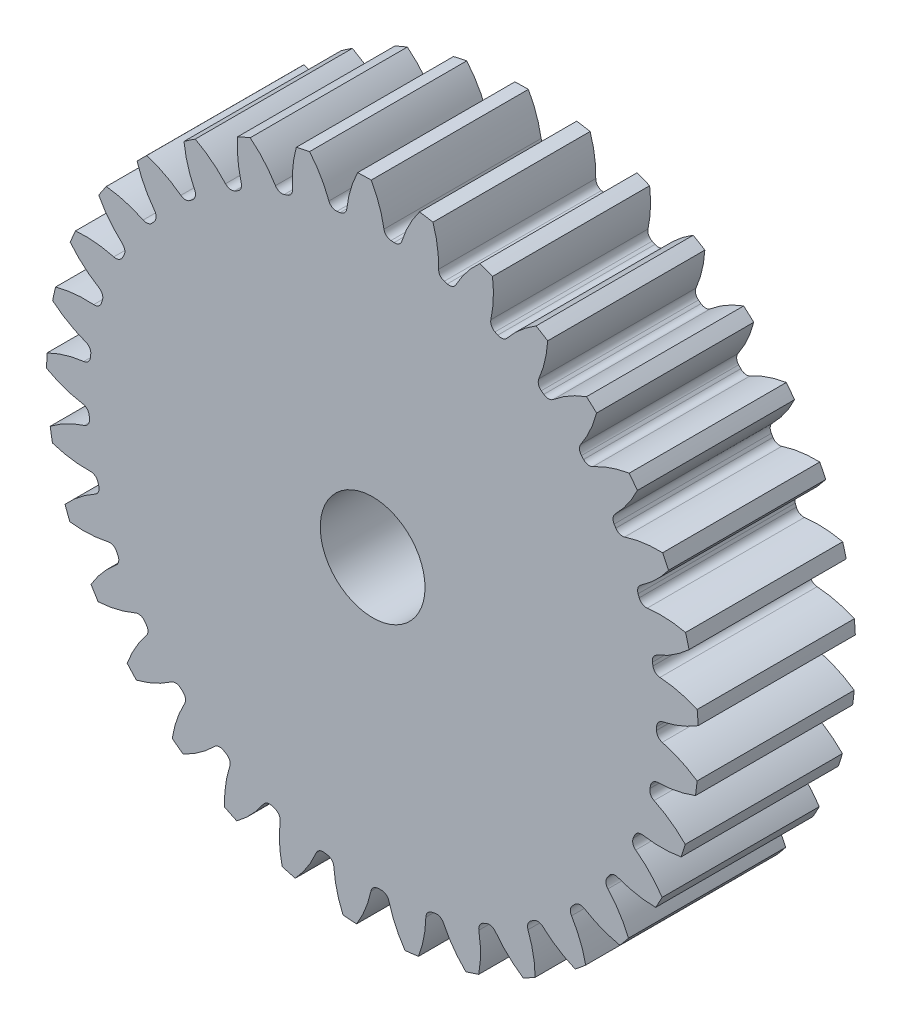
SolidWorks part; units mm, degrees
ref_plane "Front" through (0, 0, 0) normal (0, 0, 1) x (1, 0, 0)
ref_plane "Top" through (0, 0, 0) normal (0, 1, 0) x (1, 0, 0)
ref_plane "Right" through (0, 0, 0) normal (1, 0, 0) x (0, 0, -1)
sketch "Sketch3" plane through (0, 0, 0) normal (0, 0, 1) x (1, 0, 0)
  circle A0 centre (0, 0) radius 197.5556
  dimension "od" = 395.1111
extrude "gearBody" add sketch "Sketch3" along normal blind 95.25
sketch "Sketch2" plane through (0, 0, 0) normal (0, 0, 1) x (1, 0, 0)
  line L0 (0, 0) -> (161.7098, 66.9824) construction
  line L1 (196.8888, -19.271) -> (0, 0) construction
  line L2 (0, 0) -> (36.3143, 0) construction
  line L3 (186.2086, 4.6511) -> (185.8119, -13.0086) construction
  line L5 (186.0102, -4.1787) -> (0, 0) construction
  line L7 (0, 0) -> (175.0334, 0) construction
  arc A0 (175.0282, 1.3471) -> (174.7912, -9.2058) centre (0, 0) ccw construction
  arc A1 (197.2899, 10.2423) -> (196.6309, -19.0918) centre (0, 0) ccw construction
  arc A2 (186.2086, 4.6511) -> (185.8119, -13.0086) centre (0, 0) ccw construction
  arc A3 (172.0881, -4.8183) -> (172.1309, -2.9145) centre (0, 0) ccw
  arc A4 (196.8888, -19.271) -> (175.5162, -9.3914) centre (158.5386, -74.1768) ccw
  arc A5 (196.8888, -19.271) -> (197.5556, 10.4098) centre (0, 0) ccw
  arc A6 (197.5556, 10.4098) -> (175.7609, 1.5) centre (161.7098, 66.9824) cw
  arc A7 (172.1309, -2.9145) -> (175.7609, 1.5) centre (176.7248, -2.9923) cw
  arc A8 (175.5162, -9.3914) -> (172.0881, -4.8183) centre (176.6809, -4.9469) cw
  point P6 (197.5556, 10.4098)
  point P22 (196.8888, -19.271)
  dimension "baseDia" = 350.0668
  dimension "od" = 395.1111
  dimension "pd" = 372.5333
  dimension "rd" = 344.3111
  dimension "rFillet" = 4.5946
  dimension "pointX" = 197.5556
  dimension "pointY" = 10.4098
  dimension "CTT" = 17.6597
  dimension "flankCenterAngle" = 22.5
extrude "toothCut" cut sketch "Sketch2" along normal through all
pattern_circular "CirPattern1" count 33 over 360 about axis through (0, 0, 0) along (0, 0, 1) of "toothCut"
sketch "hub1Dia" plane through (0, 0, 0) normal (0, 0, -1) x (-1, 0, 0)
  circle A0 centre (0, 0) radius 12.7
  dimension "hub1Dia" = 25.4
sketch "hub2Dia" plane through (0, 0, 95.25) normal (0, 0, 1) x (1, 0, 0)
  circle A0 centre (0, 0) radius 12.7
  dimension "hub2dia" = 25.4
sketch "boreDia" plane through (0, 0, 0) normal (0, 0, 1) x (1, 0, 0)
  circle A0 centre (0, 0) radius 31.75
  dimension "boreDia" = 63.5
extrude "bore" cut sketch "boreDia" against normal mid plane 25400
